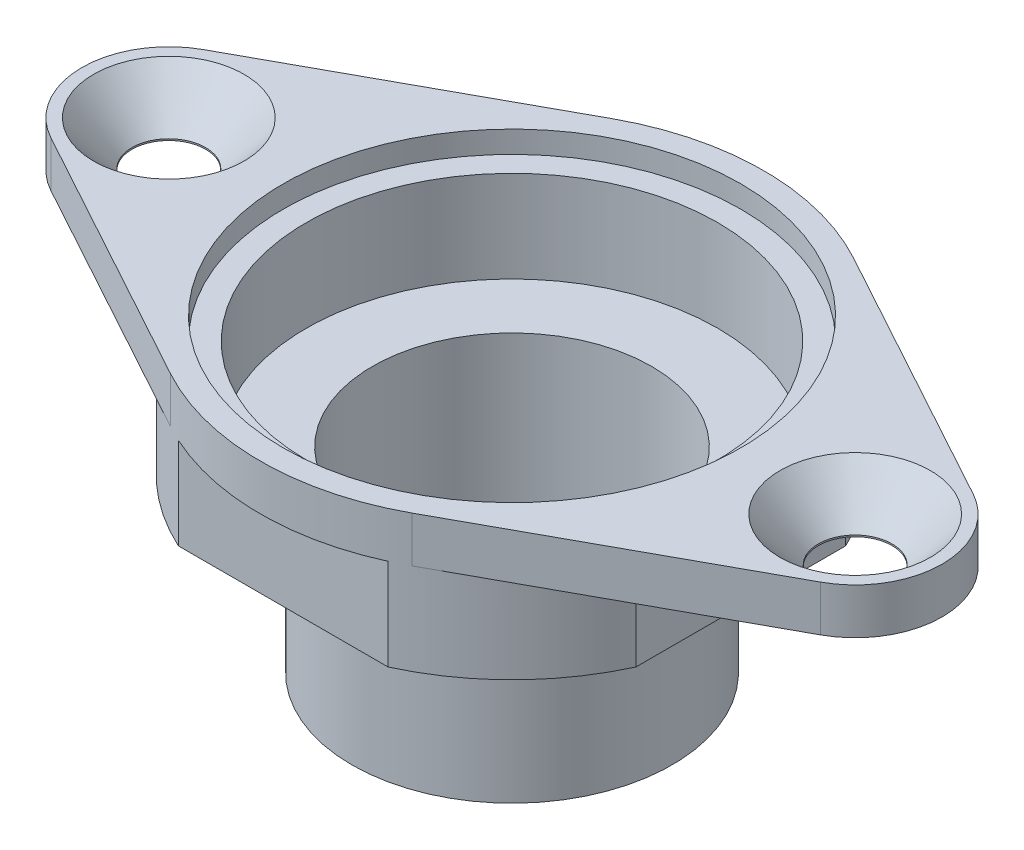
SolidWorks part; units mm, degrees
ref_plane "Front Plane" through (0, 0, 0) normal (0, 0, 1) x (1, 0, 0)
ref_plane "Top Plane" through (0, 0, 0) normal (0, 1, 0) x (1, 0, 0)
ref_plane "Right Plane" through (0, 0, 0) normal (1, 0, 0) x (0, 0, -1)
sketch "Sketch1" plane through (0, 0, 0) normal (0, 1, 0) x (1, 0, 0)
  line L1 (0, 0) -> (63.5, 0)
  line L2 (0, 0) -> (0, 50.8)
  line L3 (0, 50.8) -> (63.5, 50.8)
  line L4 (63.5, 0) -> (63.5, 50.8)
  dimension "D1" = 63.5
  dimension "D2" = 50.8
extrude "Boss-Extrude1" add sketch "Sketch1" along normal blind 22.225
sketch "Sketch2" plane through (0, 22.225, 0) normal (0, 1, 0) x (1, 0, 0)
  line L0 (31.75, 50.8) -> (31.75, 0) construction
  line L1 (63.5, 50.8) -> (0, 50.8) construction
  line L2 (0, 0) -> (63.5, 0) construction
  circle A0 centre (31.75, 25.4) radius 14.2684
  dimension "D1" = 28.5369
extrude "Cut-Extrude1" cut sketch "Sketch2" against normal blind 7.874
sketch "Sketch5" plane through (0, 22.225, 0) normal (0, 1, 0) x (1, 0, 0)
  circle A0 centre (31.75, 25.4) radius 15.875
  dimension "D1" = 31.75
extrude "Cut-Extrude3" cut sketch "Sketch5" against normal blind 1.524
hole_wizard "CSK for #10 Flat Head Machine Screw1" positions "Sketch8" profile "Sketch7" countersink size "#10" standard "ANSI Inch"
sketch "Sketch8" plane through (0, 22.225, 0) normal (0, 1, 0) x (1, 0, 0)
  line L0 (31.75, 41.275) -> (31.75, 9.525) construction
  circle A0 centre (31.75, 25.4) radius 15.875 construction
  circle A1 centre (31.75, 25.4) radius 15.875 construction
  point P0 (7.9375, 25.4)
  point P3 (55.5625, 25.4)
  dimension "D1" = 47.625
sketch "Sketch7" plane through (7.9375, 22.225, -25.4) normal (1, 0, 0) x (0, 0, 1)
  line L0 (0, 0) -> (0, 22.225)
  line L1 (0, 22.225) -> (2.5527, 22.225)
  line L2 (2.5527, 22.225) -> (2.5527, 3.0692)
  line L3 (2.5527, 3.0692) -> (5.2207, 0)
  line L5 (5.2207, 0) -> (0, 0)
  line L6 (-2.5527, 3.0692) -> (-5.2207, 0) construction
  line L11 (0, -6.35) -> (0, 107.95) construction
  dimension "Thru Hole Dia." = 5.1054
  dimension "Thru Hole Depth" = 22.225
  dimension "Near C'Sink Dia." = 10.4414
  dimension "Near C'Sink Angle" = 82
sketch "Sketch10" plane through (0, 22.225, 0) normal (0, 1, 0) x (1, 0, 0)
  line L1 (40.132, 40.7193) -> (58.4581, 30.6921)
  line L2 (58.4581, 20.1079) -> (40.132, 10.0807)
  line L4 (5.0419, 30.6921) -> (23.368, 40.7193)
  line L5 (5.0419, 20.1079) -> (23.368, 10.0807)
  arc A0 (23.368, 10.0807) -> (40.132, 10.0807) centre (31.75, 25.4) ccw
  arc A1 (5.0419, 30.6921) -> (5.0419, 20.1079) centre (7.9375, 25.4) ccw
  arc A2 (58.4581, 20.1079) -> (58.4581, 30.6921) centre (55.5625, 25.4) ccw
  arc A3 (40.132, 40.7193) -> (23.368, 40.7193) centre (31.75, 25.4) ccw
  dimension "D1" = 34.925
  dimension "D2" = 12.065
extrude "Cut-Extrude5" cut sketch "Sketch10" against normal blind 25.4 flip side to cut
sketch "Sketch11" plane through (0, 0, 0) normal (0, -1, 0) x (-1, 0, 0)
  line L0 (-1.905, 25.4) -> (-61.595, 25.4) construction
  line L1 (-15.875, 9.525) -> (-47.625, 9.525)
  line L2 (-15.875, 9.525) -> (-15.875, 41.275)
  line L3 (-15.875, 41.275) -> (-47.625, 41.275)
  line L4 (-47.625, 9.525) -> (-47.625, 41.275)
  line L5 (-31.75, 7.9375) -> (-31.75, 42.8625) construction
  arc A4 (-58.4581, 30.6921) -> (-58.4581, 20.1079) centre (-55.5625, 25.4) ccw construction
  arc A5 (-5.0419, 20.1079) -> (-5.0419, 30.6921) centre (-7.9375, 25.4) ccw construction
  dimension "D1" = 31.75
  dimension "D2" = 31.75
extrude "Cut-Extrude7" cut sketch "Sketch11" against normal blind 19.05 flip side to cut
sketch "Sketch12" plane through (0, 14.351, 0) normal (0, 1, 0) x (1, 0, 0)
  circle A0 centre (31.75, 25.4) radius 7.9184
  circle A1 centre (31.75, 25.4) radius 14.2684 construction
  dimension "D1" = 6.35
extrude "Cut-Extrude8" cut sketch "Sketch12" against normal through all
sketch "Sketch13" plane through (0, 0, 0) normal (0, -1, 0) x (-1, 0, 0)
  circle A0 centre (-31.75, 25.4) radius 11.1125
  dimension "D1" = 22.225
extrude "Cut-Extrude9" cut sketch "Sketch13" against normal blind 12.7 flip side to cut
sketch "Sketch15" plane through (0, 0, 0) normal (0, -1, 0) x (-1, 0, 0)
  circle A0 centre (-31.75, 25.4) radius 9.6837
  dimension "D1" = 19.3675
extrude "Cut-Extrude11" cut sketch "Sketch15" against normal through all
sketch "Sketch17" plane through (5.0015, 0, 9.141) normal (0.48, 0, 0.8773) x (0.8773, 0, -0.48)
  line L1 (0, 0) -> (57.4622, 0)
  line L2 (0, 0) -> (0, 0.7937)
  line L3 (0, 0.7937) -> (57.4622, 0.7937)
  line L4 (57.4622, 0) -> (57.4622, 0.7937)
  dimension "D1" = 0.7937
extrude "Cut-Extrude14" cut sketch "Sketch17" against normal through all
sketch "Sketch18" plane through (0, 12.7, 0) normal (0, -1, 0) x (1, 0, 0)
  circle A0 centre (31.75, -25.4) radius 17.4625
extrude "Cut-Extrude15" cut sketch "Sketch18" against normal up to surface (6.35 mm away) flip side to cut
